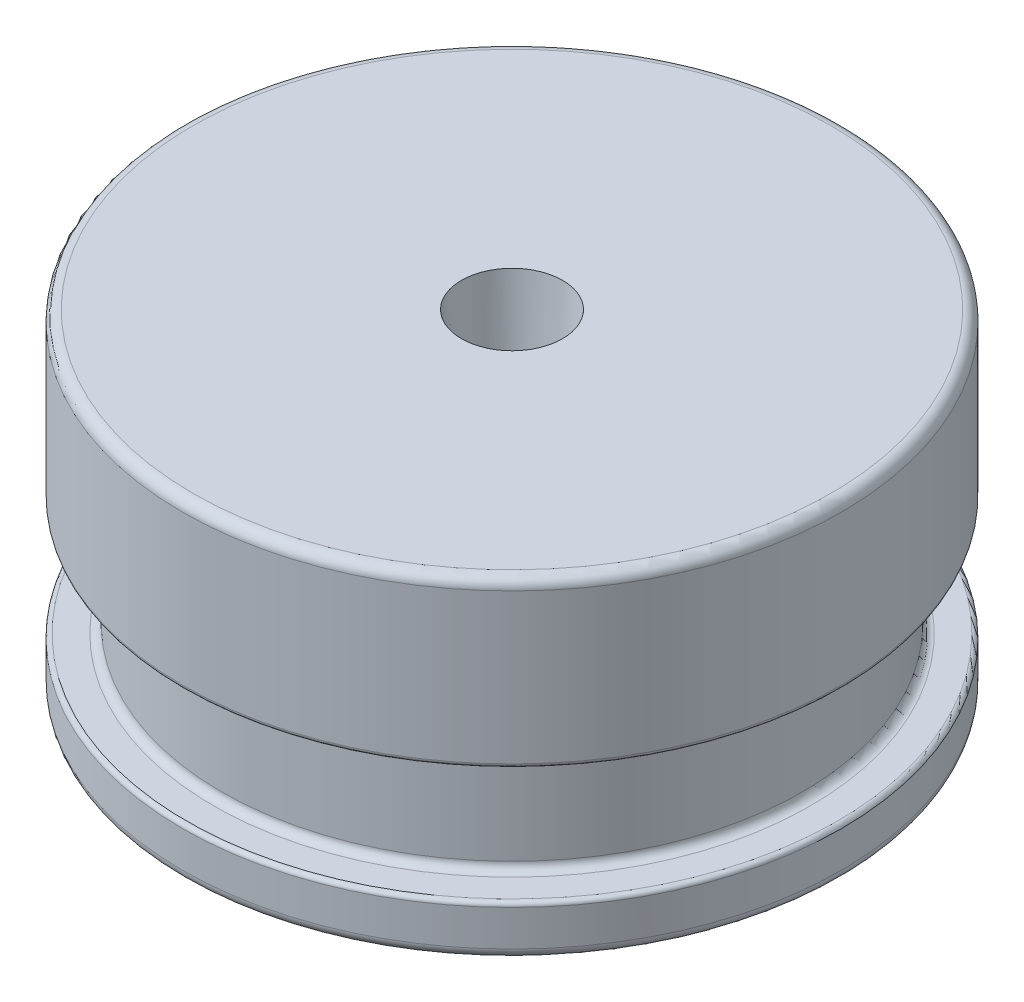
SolidWorks part; units mm, degrees
ref_plane "Front" through (0, 0, 0) normal (0, 0, 1) x (1, 0, 0)
ref_plane "Top" through (0, 0, 0) normal (0, 1, 0) x (1, 0, 0)
ref_plane "Right" through (0, 0, 0) normal (1, 0, 0) x (0, 0, -1)
sketch "Sketch1" plane through (0, 0, 0) normal (0, 0, 1) x (1, 0, 0)
  line L0 (0, 19.7432) -> (0, 0) construction
  line L1 (1.7272, 0) -> (1.7272, 1.27)
  line L2 (1.7272, 0) -> (15.5575, 0)
  line L3 (15.5575, 0) -> (15.5575, 2.413)
  line L4 (1.7272, 1.27) -> (11.43, 2.1189)
  line L5 (11.43, 2.1189) -> (12.7, 2.1189)
  line L8 (12.7, 2.1189) -> (12.7, 8.9769)
  line L9 (12.7, 8.9769) -> (14.544, 8.9769)
  line L10 (14.544, 8.9769) -> (14.544, 9.9929)
  line L11 (14.544, 9.9929) -> (13.7312, 9.9929)
  line L12 (13.7312, 9.9929) -> (13.7312, 13.2949)
  line L13 (13.7312, 13.2949) -> (15.5575, 13.2949)
  line L14 (15.5575, 13.2949) -> (15.5575, 7.874)
  line L15 (13.716, 7.874) -> (15.5575, 7.874)
  line L16 (13.716, 7.874) -> (13.716, 2.413)
  line L17 (13.716, 2.413) -> (15.5575, 2.413)
  dimension "D1" = 5
  dimension "D2" = 3.4544
  dimension "D3" = 1.27
  dimension "D4" = 1.8415
  dimension "D5" = 5.461
  dimension "D6" = 1.016
  dimension "D7" = 6.858
  dimension "D8" = 1.27
  dimension "D9" = 25.4
  dimension "D10" = 27.432
  dimension "D11" = 31.115
  dimension "D12" = 3.302
  dimension "D13" = 13.7312
  dimension "D14" = 0.8128
  dimension "D15" = 1.016
  dimension "D17" = 2.413
  dimension "D19" = 1.0135
  dimension "D21" = 13.2949
revolve "Revolve1" add sketch "Sketch1" angle 360 about L0
ref_plane "Plane1" through (0, 14.732, 0) normal (0, 1, 0) x (-1, 0, 0)
fillet "Fillet3" radius 0.381 2 edges at (0, 2.413, 13.716) (0, 7.874, 13.716)
sketch "Sketch2" plane through (0, 13.2949, 0) normal (0, 1, 0) x (-1, 0, 0)
  circle A0 centre (0, 0) radius 15.5575
  circle A1 centre (0, 0) radius 15.5575 construction
extrude "Extrude2" add sketch "Sketch2" along normal blind 2.3622
sketch "Sketch3" plane through (0, 0, 0) normal (0, -1, 0) x (1, 0, 0)
  circle A0 centre (0, 0) radius 12.7
  circle A1 centre (0, 0) radius 12.7 construction
  circle A2 centre (0, 0) radius 1.7272
  circle A3 centre (0, 0) radius 1.7272 construction
extrude "Extrude3" add sketch "Sketch3" against normal up to surface (15.6571 mm away)
fillet "Fillet4" radius 0.508 2 edges at (0, 0, 15.5575) (0, 15.6571, 15.5575)
sketch "Sketch5" plane through (0, 8.9769, 0) normal (0, 1, 0) x (-1, 0, 0)
  circle A0 centre (0, 0) radius 14.544
  circle A1 centre (0, 0) radius 14.544 construction
extrude "Extrude4" add sketch "Sketch5" along normal up to surface (6.6802 mm away)
sketch "Sketch4" plane through (0, 0, 0) normal (0, -1, 0) x (1, 0, 0)
  circle A0 centre (0, 0) radius 1.7272
  circle A1 centre (0, 0) radius 1.7272 construction
extrude "Cut-Extrude1" cut sketch "Sketch4" against normal through all
sketch "Sketch7" plane through (0, 0, 0) normal (0, 0, 1) x (1, 0, 0)
  line L0 (0, 0) -> (0, 18.7235) construction
  line L1 (15.0495, 15.6571) -> (-15.0495, 15.6571) construction
  circle A0 centre (10.414, -1.8689) radius 3.175
  dimension "D1" = 6.35
  dimension "D2" = 17.526
  dimension "D3" = 10.414
revolve "Cut-Revolve1" cut sketch "Sketch7" angle 360 about L0
fillet "Fillet5" radius 0.2032 2 edges at (0, 2.413, 15.5575) (0, 7.874, 15.5575)
sketch "Sketch8" plane through (0, 0, 0) normal (0, 0, 1) x (1, 0, 0)
  line L0 (0, 0) -> (0, 17.3864) construction
  line L1 (1.7272, 15.6571) -> (2.3876, 15.6571)
  line L2 (1.7272, 15.6571) -> (-1.7272, 15.6571) construction
  line L3 (15.0495, 15.6571) -> (-15.0495, 15.6571) construction
  line L4 (1.7272, 15.6571) -> (1.7272, 8.1087)
  line L5 (1.7272, 0) -> (1.7272, 15.6571) construction
  line L6 (1.7272, 8.1087) -> (2.3876, 15.6571)
  dimension "D1" = 4.7752
  dimension "D2" = 5
revolve "Cut-Revolve2" cut sketch "Sketch8" angle 360 about L0
